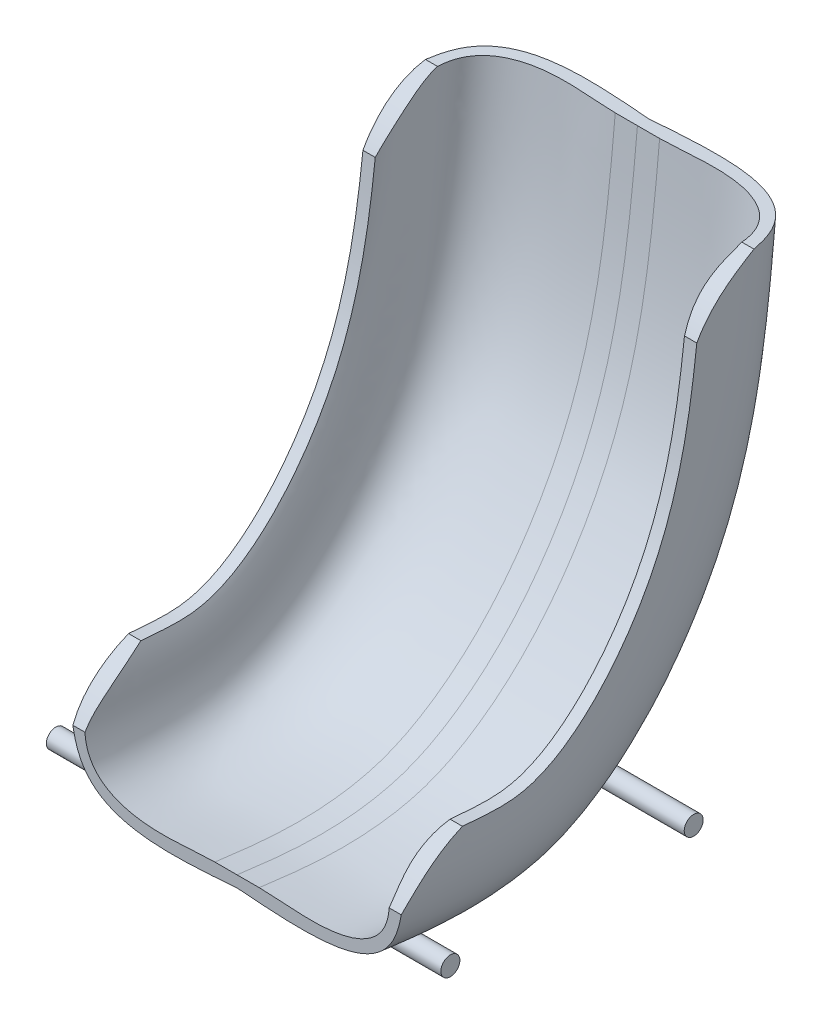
SolidWorks part; units mm, degrees
ref_plane "Face" through (0, 0, 0) normal (0, 0, 1) x (1, 0, 0)
ref_plane "Dessus" through (0, 0, 0) normal (0, 1, 0) x (1, 0, 0)
ref_plane "Droite" through (0, 0, 0) normal (1, 0, 0) x (0, 0, -1)
sketch "Esquisse1" plane through (0, 0, 0) normal (0, 0, 1) x (1, 0, 0)
  line L0 (0, 18.3822) -> (0, -38.9535) construction
  line L1 (-220, 150) -> (-203.7309, 150)
  line L2 (0, 0) -> (0, 14.9735)
  line L3 (-29.2182, 14.9735) -> (0, 14.9735)
  spline_without_curve S0
  spline_without_curve S1
  dimension "D1" = 220
  dimension "D2" = 150
sketch "Esquisse2" plane through (0, 0, 0) normal (1, 0, 0) x (0, 0, -1)
  spline_without_curve S0
sweep "Base-Balayage" add profiles "Esquisse1" path "Esquisse2"
sketch "Esquisse3" plane through (0, 0, 0) normal (1, 0, 0) x (0, 0, -1)
  line L0 (508.9513, 612.1511) -> (508.9513, 678.6679)
  line L1 (508.9513, 678.6679) -> (-112.4523, 678.6679)
  line L2 (371.1073, 496.7157) -> (103.7503, 496.7157)
  line L3 (103.7503, 150.3227) -> (103.7503, 496.7157)
  line L4 (-7.9146, 63.7943) -> (-112.4523, 63.7943)
  line L5 (-112.4523, 63.7943) -> (-112.4523, 678.6679)
  arc A0 (508.9513, 612.1511) -> (371.1073, 496.7157) centre (508.9513, 472.132) ccw
  arc A1 (103.7503, 150.3227) -> (-7.9146, 63.7943) centre (140.7786, -12.7783) ccw
extrude "Enlèv. mat.-Extru.1" cut sketch "Esquisse3" against normal through all
sketch "Esquisse4" plane through (0, 0, 0) normal (1, 0, 0) x (0, 0, -1)
  circle A0 centre (61.1757, -9.4063) radius 12.5
  dimension "D1" = 25
extrude "Boss.-Extru.3" add sketch "Esquisse4" against normal blind 300
sketch "Esquisse5" plane through (0, 0, 0) normal (1, 0, 0) x (0, 0, -1)
  line L0 (473.6117, 297.454) -> (370.9865, -5.8666)
  line L3 (382.8271, -9.8727) -> (485.4524, 293.4478)
  line L4 (485.4524, 293.4478) -> (473.6117, 297.454)
  line L5 (373.2801, -38.0901) -> (524.5804, 409.095) construction
  line L7 (370.9865, -5.8666) -> (382.8271, -9.8727)
  dimension "D1" = 12.5
revolve "Boss.-Révol.1" add sketch "Esquisse5" angle 360 about L5
sketch "Esquisse6" plane through (0, 0, 0) normal (1, 0, 0) x (0, 0, -1)
  line L0 (61.1757, -9.4063) -> (656.0451, -9.4063) construction
  circle A0 centre (381.8396, -9.4063) radius 12.5
  dimension "D1" = 25
extrude "Boss.-Extru.4" add sketch "Esquisse6" against normal blind 300
mirror "Tout symétriser2"
sketch "Esquisse7" plane through (300, 0, 0) normal (1, 0, 0) x (0, 0, -1)
  line L1 (48.6757, 3.0937) -> (394.3396, 3.0937)
  line L2 (48.6757, 3.0937) -> (48.6757, -21.9063)
  line L3 (48.6757, -21.9063) -> (394.3396, -21.9063)
  line L4 (394.3396, 3.0937) -> (394.3396, -21.9063)
  circle A0 centre (381.8396, -9.4063) radius 12.5 construction
  circle A1 centre (61.1757, -9.4063) radius 12.5 construction
extrude "Enlèv. mat.-Extru.2" cut sketch "Esquisse7" against normal blind 80
